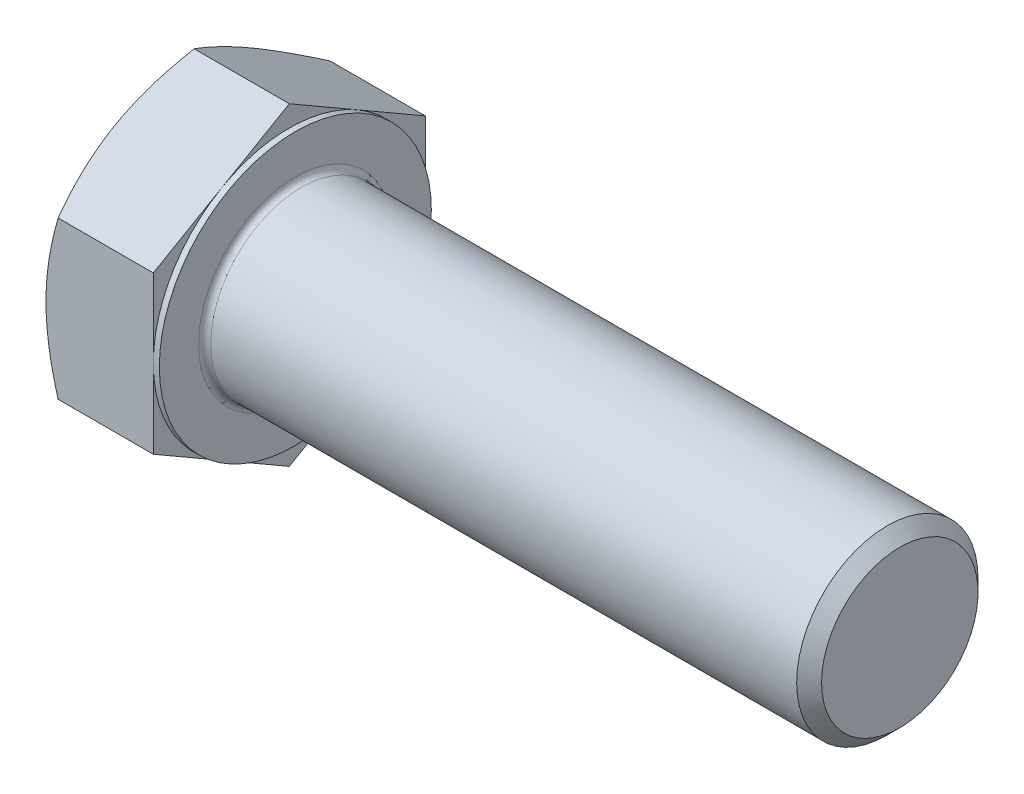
SolidWorks part; units mm, degrees
ref_plane "Front Plane" through (0, 0, 0) normal (0, 0, 1) x (1, 0, 0)
ref_plane "Top Plane" through (0, 0, 0) normal (0, 1, 0) x (1, 0, 0)
ref_plane "Right Plane" through (0, 0, 0) normal (1, 0, 0) x (0, 0, -1)
sketch "BaseHeadSke" plane through (0, 0, 0) normal (1, 0, 0) x (0, 0, -1)
  line L1 (18, 10.3923) -> (0, 20.7846)
  line L2 (0, 20.7846) -> (-18, 10.3923)
  line L3 (-18, 10.3923) -> (-18, -10.3923)
  line L4 (-18, -10.3923) -> (0, -20.7846)
  line L5 (0, -20.7846) -> (18, -10.3923)
  line L6 (18, -10.3923) -> (18, 10.3923)
  circle A0 centre (0, 0) radius 18 construction
  dimension "Width_flats" = 36
extrude "BaseHead" add sketch "BaseHeadSke" along normal blind 15
sketch "BodySke" plane through (0, 0, 0) normal (0, 0, 1) x (1, 0, 0)
  line L0 (0, 0) -> (95, 0)
  line L1 (95, 0) -> (95, 10.352)
  line L2 (95, 10.352) -> (93.352, 12)
  line L3 (93.352, 12) -> (0, 12)
  line L4 (0, 12) -> (0, 0)
  line L5 (15, 10.3923) -> (15, -10.3923) construction
  line L6 (0, 0) -> (159.3976, 0) construction
  line L7 (15, -84.3176) -> (15, 77.7215) construction
  line L8 (92, -21.5941) -> (92, 39.2994) construction
  dimension "Ang" = 45
  dimension "Length" = 80
  dimension "Diameter" = 24
  dimension "Minor_dia" = 20.704
  dimension "Thread_length" = 80
  dimension "Advance" = 3
revolve "BaseBody" add sketch "BodySke" angle 360 about L6
sketch "HeadChamferSke" plane through (0, 0, 0) normal (0, 0, 1) x (1, 0, 0)
  line L0 (1.6077, 20.7846) -> (0, 20.7846)
  line L1 (0, 20.7846) -> (0, 18)
  line L2 (0, 18) -> (1.6077, 20.7846)
  line L3 (0, 0) -> (120.9185, 0) construction
  dimension "D1" = 30
  dimension "Head_chamfer" = 36
revolve "HeadChamfer" cut sketch "HeadChamferSke" angle 360 about L3
sketch "BearingFaceSke" plane through (0, 0, 0) normal (0, 0, 1) x (1, 0, 0)
  line L0 (0, 0) -> (129.6443, 0) construction
  line L1 (14.2, 20.7846) -> (15, 20.7846)
  line L2 (14.2, 20.7846) -> (14.2, 18)
  line L3 (14.2, 18) -> (15, 18)
  line L4 (15, 20.7846) -> (15, 18)
  dimension "D1" = 36
  dimension "Bearing_height" = 0.8
revolve "BearingFace" cut sketch "BearingFaceSke" angle 360 about L0
fillet "Fillet" radius 0.8 1 edges at (15, 0, 12)
sketch "ThdSchSke" plane through (0, 0, 0) normal (0, 0, 1) x (1, 0, 0)
  line L0 (91.0485, 13.9029) -> (91.0485, 12)
  line L1 (91.0485, 12) -> (92, 10.352)
  line L2 (92, 10.352) -> (92.9515, 12)
  line L3 (92.9515, 12) -> (92.9515, 13.9029)
  line L4 (92.9515, 13.9029) -> (91.0485, 13.9029)
  line L6 (0, 0) -> (141.9934, 0) construction
  line L7 (95, -10.352) -> (95, 10.352) construction
  dimension "D2" = 20.704
  dimension "D3" = 24
  dimension "Advance" = 3
revolve "ThreadSchematic" [suppressed] cut sketch "ThdSchSke" angle 360 about L6
pattern_linear "ThdSchPat" [suppressed] count 25 spacing 3 along (1, 0, 0)
equation "\"Thread_minor@ThreadCosmetic\" = \"Minor_dia@BodySke\""
equation "\"Thread_length@ThreadCosmetic\" = \"Thread_length@BodySke\""
equation "\"Head_chamfer@HeadChamferSke\" = \"Width_flats@BaseHeadSke\""
equation "\"D1@BearingFaceSke\" = \"Width_flats@BaseHeadSke\""
equation "\"D2@ThdSchSke\" = \"Minor_dia@BodySke\""
equation "\"D3@ThdSchSke\" = \"Diameter@BodySke\""
equation "\"Advance@ThdSchSke\" = \"Advance@BodySke\""
equation "\"D3@ThdSchPat\" = \"Advance@BodySke\""
equation "\"D1@ThdSchPat\" =  int( \"Thread_length@BodySke\"/\"Advance@BodySke\" )-1"
